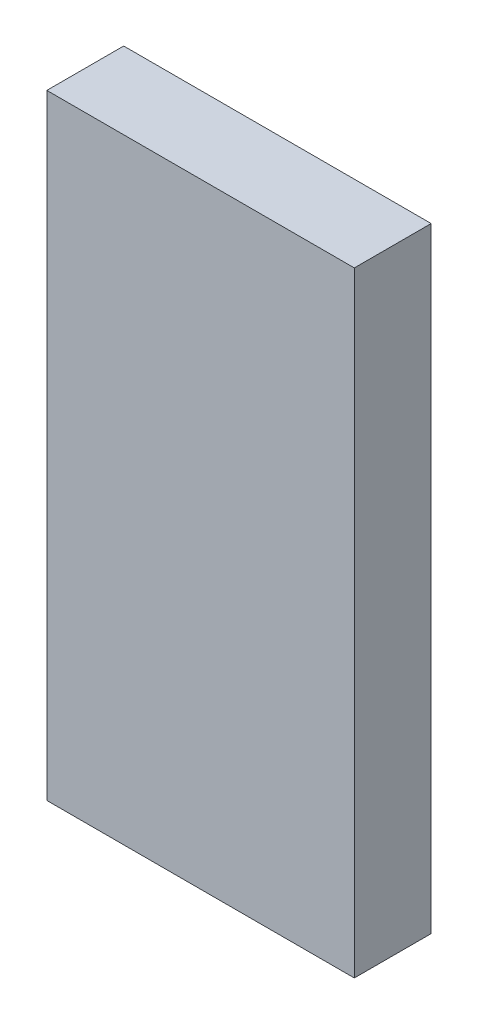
SolidWorks part; units mm, degrees
ref_plane "Front Plane" through (0, 0, 0) normal (0, 0, 1) x (1, 0, 0)
ref_plane "Top Plane" through (0, 0, 0) normal (0, 1, 0) x (1, 0, 0)
ref_plane "Right Plane" through (0, 0, 0) normal (1, 0, 0) x (0, 0, -1)
sketch "Sketch1" plane through (0, 0, 0) normal (0, 0, 1) x (1, 0, 0)
  line L1 (-43.2611, 34.4248) -> (7.5389, 34.4248)
  line L2 (-43.2611, 34.4248) -> (-43.2611, -67.1752)
  line L3 (-43.2611, -67.1752) -> (7.5389, -67.1752)
  line L4 (7.5389, 34.4248) -> (7.5389, -67.1752)
extrude "Boss-Extrude1" add sketch "Sketch1" along normal blind 12.7
sketch "Sketch2" plane through (0, 0, 12.7) normal (0, 0, 1) x (1, 0, 0)
  line L0 (-43.2611, 9.0248) -> (7.5389, 9.0248)
  line L1 (-43.2611, 34.4248) -> (-43.2611, -67.1752) construction
  line L2 (7.5389, -67.1752) -> (7.5389, 34.4248) construction
  line L3 (-43.2611, -67.1752) -> (7.5389, -67.1752) construction
  line L4 (7.5389, -67.1752) -> (7.5389, 34.4248) construction
  dimension "D1" = 76.2
hole_wizard "#8 (0.199) Diameter Hole1" positions "Sketch9" profile "Sketch10" hole size "#8" standard "ANSI Inch"
sketch "Sketch9" plane through (0, -67.1752, 0) normal (0, -1, 0) x (-1, 0, 0)
  line L0 (43.2611, 0) -> (-7.5389, 0) construction
  line L1 (-7.5389, -12.7) -> (-7.5389, 0) construction
  point P0 (-0.0967, -6.35)
  point P2 (35.8243, -6.35)
  dimension "D1" = 6.35
  dimension "D2" = 7.4422
  dimension "D3" = 6.35
  dimension "D4" = 35.921
sketch "Sketch10" plane through (0.0967, -67.1752, 6.35) normal (1, 0, 0) x (0, 0, -1)
  line L0 (0, 0) -> (0, 14.2186)
  line L1 (0, 14.2186) -> (2.5273, 12.7)
  line L2 (2.5273, 12.7) -> (2.5273, 0.635)
  line L3 (2.5273, 0.635) -> (3.1623, 0)
  line L5 (3.1623, 0) -> (0, 0)
  line L6 (-2.5273, 0.635) -> (-3.1623, 0) construction
  line L10 (0, 14.2186) -> (-2.5273, 12.7) construction
  line L11 (0, -6.35) -> (0, 107.95) construction
  dimension "Hole Dia." = 5.0546
  dimension "Hole Depth" = 12.7
  dimension "Near C'Sink Dia." = 6.3246
  dimension "Near C'Sink Angle" = 90
  dimension "Drill Angle" = 118
hole_wizard "#8-32 Tapped Hole3" positions "Sketch13" profile "Sketch14" tap size "#8-32" standard "ANSI Inch"
sketch "Sketch13" plane through (0, 0, 0) normal (0, 0, -1) x (-1, 0, 0)
  line L0 (-7.5389, -67.1752) -> (-7.5389, 34.4248) construction
  line L1 (43.2611, -67.1752) -> (-7.5389, -67.1752) construction
  point P0 (-0.0967, -60.8252)
  point P2 (35.8243, -60.8252)
  dimension "D1" = 7.4422
  dimension "D2" = 6.35
  dimension "D3" = 35.921
  dimension "D4" = 6.35
sketch "Sketch14" plane through (0.0967, -60.8252, 0) normal (1, 0, 0) x (0, 1, 0)
  line L0 (0, 0) -> (0, 3.8227)
  line L1 (0, 3.8227) -> (1.7272, 3.8227)
  line L2 (1.7272, 3.8227) -> (1.7272, 1.4351)
  line L3 (1.7272, 1.4351) -> (3.1623, 0)
  line L5 (3.1623, 0) -> (0, 0)
  line L6 (-1.7272, 1.4351) -> (-3.1623, 0) construction
  line L11 (0, -6.35) -> (0, 107.95) construction
  dimension "Thru Tap Drill Dia." = 3.4544
  dimension "Thru Tap Drill Depth" = 3.8227
  dimension "Near C'Sink Dia." = 6.3246
  dimension "Near C'Sink Angle" = 90
sketch "Sketch15" plane through (7.5389, 0, 0) normal (1, 0, 0) x (0, 0, -1)
  line L0 (-12.8778, 9.0248) -> (0, 9.0248)
  line L1 (0, -67.1752) -> (0, 34.4248) construction
  line L2 (0, 9.0248) -> (-12.8778, 9.0248)
  line L3 (-12.7, -67.1752) -> (0, -67.1752) construction
  dimension "D1" = 76.2
sketch "Sketch16" plane through (-43.2611, 0, 0) normal (-1, 0, 0) x (0, 0, 1)
  line L0 (0, 9.0248) -> (12.8778, 9.0248)
sketch "Sketch17" plane through (0, 0, 12.7) normal (0, 0, 1) x (1, 0, 0)
  line L0 (-43.2611, 9.0248) -> (7.5389, 9.0248)
sketch "Sketch18" plane through (7.5389, 0, 0) normal (1, 0, 0) x (0, 0, -1)
  line L0 (-12.8778, 9.0248) -> (0, 9.0248)
